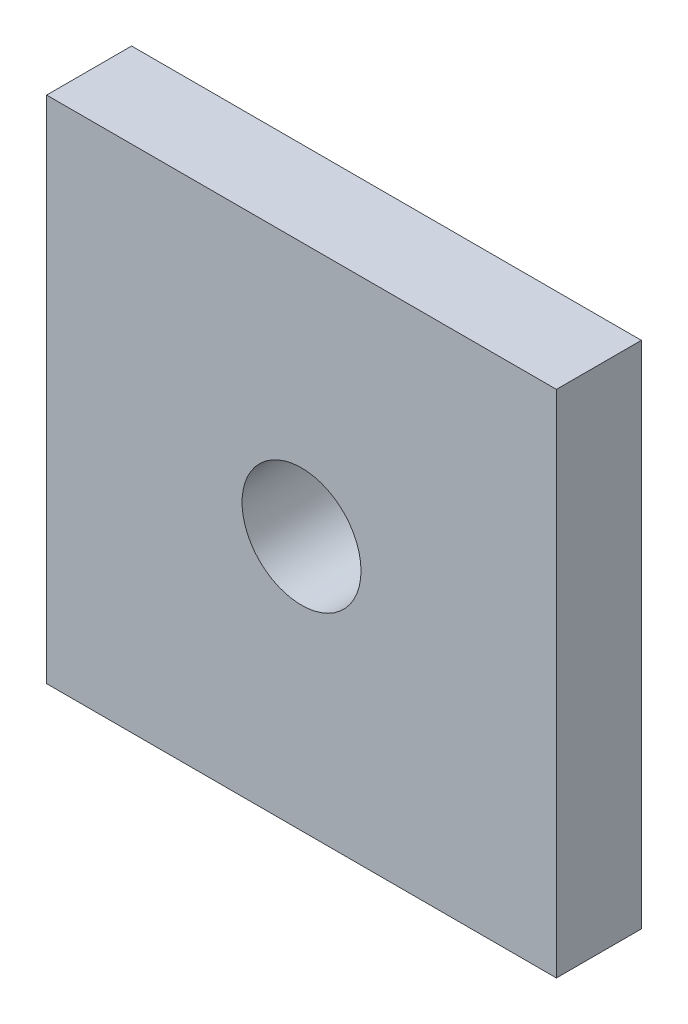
SolidWorks part; units mm, degrees
ref_plane "Ebene vorne" through (0, 0, 0) normal (0, 0, 1) x (1, 0, 0)
ref_plane "Ebene oben" through (0, 0, 0) normal (0, 1, 0) x (1, 0, 0)
ref_plane "Ebene rechts" through (0, 0, 0) normal (1, 0, 0) x (0, 0, -1)
sketch "Skizze1" plane through (0, 0, 0) normal (0, 0, 1) x (1, 0, 0)
  line L1 (0, 0) -> (60, 0)
  line L2 (0, 0) -> (0, 60)
  line L3 (0, 60) -> (60, 60)
  line L4 (60, 0) -> (60, 60)
  dimension "D1" = 60
extrude "Aufsatz-Linear austragen1" add sketch "Skizze1" along normal blind 10
sketch "Skizze2" plane through (0, 0, 10) normal (0, 0, 1) x (1, 0, 0)
  line L3 (0, 0) -> (60, 60) construction
  circle A0 centre (30, 30) radius 7
  dimension "D1" = 14
extrude "Schnitt-Linear austragen1" cut sketch "Skizze2" against normal blind 10
